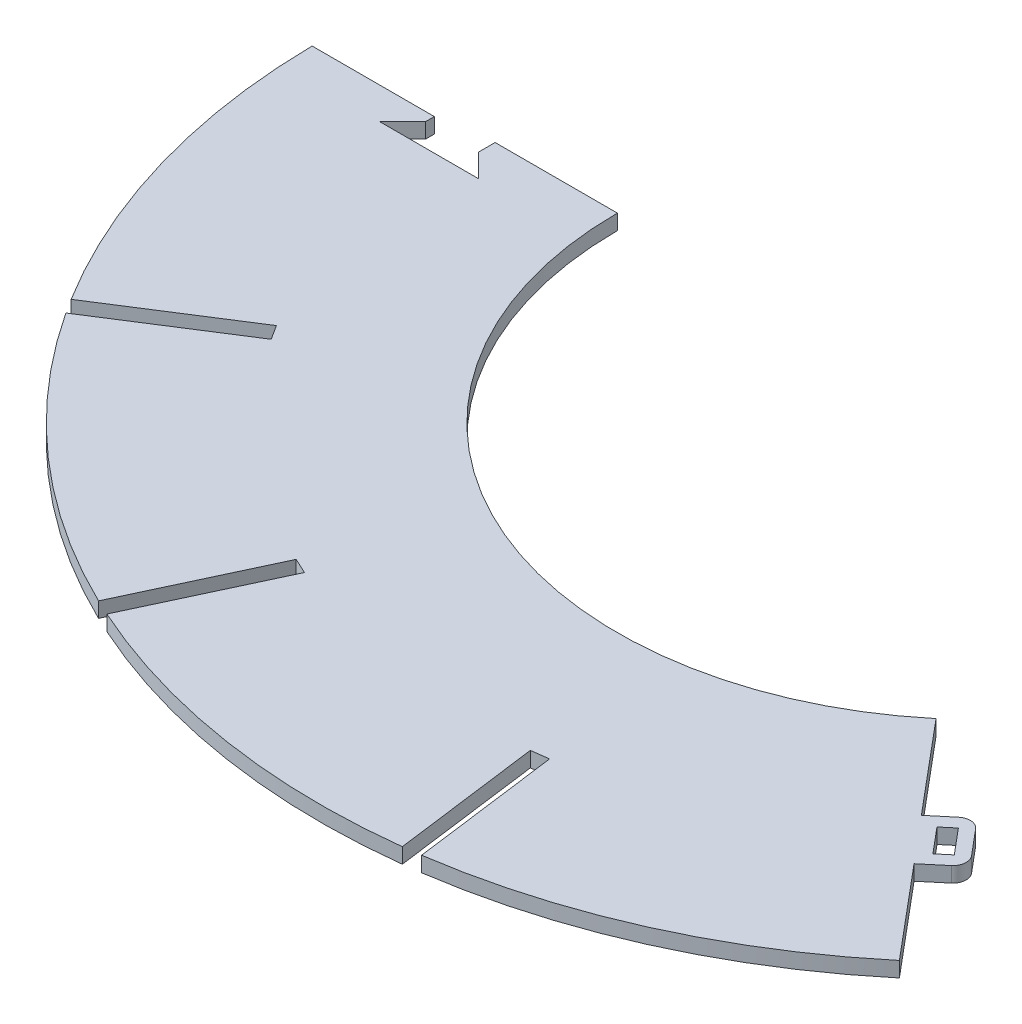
SolidWorks part; units mm, degrees
ref_plane "Alzado" through (0, 0, 0) normal (0, 0, 1) x (1, 0, 0)
ref_plane "Planta" through (0, 0, 0) normal (0, 1, 0) x (1, 0, 0)
ref_plane "Vista lateral" through (0, 0, 0) normal (1, 0, 0) x (0, 0, -1)
sketch "Croquis1" plane through (0, 0, 0) normal (0, 1, 0) x (1, 0, 0)
  line L0 (-1220, 610) -> (1220, 610) construction
  line L1 (-1220, 610) -> (-1220, -610) construction
  line L2 (1220, 610) -> (1220, -610) construction
  line L3 (1220, -610) -> (-1220, -610) construction
  line L4 (-875.8964, -108.611) -> (-875.9521, -108.6465)
  line L5 (488.8159, -101.6911) -> (546.6668, -170.6351) construction
  line L6 (-675.3886, -4.5873) -> (-675.4037, -4.5969)
  line L7 (-459.3946, -482.4337) -> (-459.4225, -482.4936)
  line L8 (-365.6503, -277.849) -> (-342.0863, -288.8371)
  line L10 (61.8741, -351.0126) -> (87.6517, -347.6189)
  line L11 (469.8808, -143.6877) -> (502.0202, -181.9899)
  line L14 (-761.3817, 418.9541) -> (-761.3817, 393.9541)
  line L15 (501.6716, -117.012) -> (533.811, -155.3142)
  line L17 (500.7041, -209.2024) -> (616.4059, -347.0904)
  line L18 (-576.3817, 418.9541) -> (-761.3817, 418.9541)
  line L19 (-841.3817, 393.9541) -> (-841.3817, 406.9541)
  line L20 (327.1514, -2.3704) -> (442.8532, -140.2584)
  line L21 (-841.3817, 393.9541) -> (-876.3817, 358.9541)
  line L22 (-876.3817, 358.9541) -> (-726.3817, 358.9541)
  line L23 (-726.3817, 358.9541) -> (-761.3817, 393.9541)
  line L24 (502.0202, -181.9899) -> (519.6392, -167.2058)
  line L26 (500.7041, -209.2024) -> (531.3459, -183.4909)
  line L27 (473.495, -114.5469) -> (442.8532, -140.2584)
  line L28 (487.4998, -128.9036) -> (469.8808, -143.6877)
  line L29 (500.7041, -209.2024) -> (546.6668, -170.6351) construction
  line L30 (486.3507, -129.8677) -> (455.709, -155.5792) construction
  line L31 (487.8483, -193.8815) -> (518.4901, -168.17) construction
  line L32 (488.8159, -101.6911) -> (442.8532, -140.2584) construction
  line L33 (-684.5227, 9.7504) -> (-684.5378, 9.7408)
  line L35 (-686.9097, 13.5653) -> (-876.6922, -107.3395)
  line L36 (-438.5495, -492.1539) -> (-438.5775, -492.2138)
  line L40 (487.4998, -128.9036) -> (519.6392, -167.2058)
  line L45 (-686.9097, 13.5653) -> (-672.9535, -8.3715)
  line L47 (-365.6503, -277.849) -> (-460.749, -481.7889)
  line L49 (61.8741, -351.0126) -> (91.2455, -574.1102)
  line L51 (-841.3817, 406.9541) -> (-1026.3097, 406.9541)
  line L53 (-672.9535, -8.3715) -> (-862.7224, -129.2676)
  line L55 (-342.0863, -288.8371) -> (-437.185, -492.7769)
  line L57 (87.6517, -347.6189) -> (117.023, -570.7165)
  line L62 (-1026.3317, 408.9541) -> (-1026.3817, 408.9541)
  line L66 (486.3507, -129.8677) -> (518.4901, -168.17) construction
  arc A2 (327.1514, -2.3704) -> (-576.3817, 418.9541) centre (-26.3817, 418.9541) cw
  arc A3 (616.4059, -347.0904) -> (116.5273, -570.7817) centre (-26.3817, 418.9541) cw
  arc A4 (533.811, -155.3142) -> (531.3459, -183.4909) centre (518.4901, -168.17) cw
  arc A5 (501.6716, -117.012) -> (473.495, -114.5469) centre (486.3507, -129.8677) ccw
  arc A19 (91.7412, -574.0449) -> (-437.6381, -492.5656) centre (-26.3817, 418.9541) cw
  arc A23 (-460.2958, -482.0002) -> (-862.991, -128.8459) centre (-26.3817, 418.9541) cw
  arc A24 (-876.4235, -107.7612) -> (-1026.3317, 408.9541) centre (-26.3817, 418.9541) cw
  point P2 (-26.3817, 801.0459)
  point P8 (-865.2061, -125.5144)
  point P10 (616.4059, 1567.0904)
  point P11 (-1026.3817, 801.0459)
  point P14 (-346.18, -286.9682)
  point P15 (-441.2964, -490.946)
  point P17 (92.7428, -573.9918)
  point P21 (-1026.3817, 418.9541)
  point P27 (458.1741, -127.4026)
  point P32 (516.025, -196.3466)
  point P39 (63.3633, -350.8321)
  point P46 (83.1949, -348.2422)
  point P47 (112.5717, -571.3813)
  point P49 (104.1445, 1792.4908)
  point P51 (86.1665, -347.83)
  point P52 (-343.4523, -288.2172)
  point P56 (-874.3402, -111.1767)
  point P57 (104.1445, -572.4908)
  point P58 (-449, -487.3537)
  point P59 (-869.7732, -118.3455)
  point P60 (45.4077, 1346.3406)
  point P61 (-449, 1707.3537)
  point P62 (-869.7732, 1338.3455)
  point P63 (-258.8218, 1299.5152)
  point P64 (-490.247, 1096.5607)
  point P65 (45.4077, -126.3406)
  point P66 (-258.8218, -79.5152)
  point P67 (-490.247, 123.4393)
  point P68 (-26.3817, 801.0459)
  point P69 (471.7787, 1394.7304)
  point P70 (-801.3817, 801.0459)
  point P71 (-26.3817, 418.9541)
  point P72 (471.7787, -174.7304)
  point P73 (-801.3817, 418.9541)
  point P74 (-484.874, 1104.9946)
  point P75 (-864.4002, 1346.7794)
  point P76 (-249.7587, 1303.7414)
  point P77 (-439.9369, 1711.5799)
  point P78 (55.3221, 1345.0353)
  point P79 (114.0589, 1791.1855)
  point P80 (-495.62, 131.8732)
  point P81 (-875.1462, -109.9116)
  point P82 (-267.8849, -75.289)
  point P83 (-458.0631, -483.1275)
  point P84 (35.4932, -127.6459)
  point P85 (94.23, -573.796)
  point P87 (-863.5942, -128.0445)
  point P88 (-361.5872, -279.7837)
  point P89 (-456.7036, -483.7614)
  point P90 (-495.62, 1088.1268)
  point P91 (-875.1462, 1329.9116)
  point P92 (-267.8849, 1295.289)
  point P93 (-458.0631, 1703.1275)
  point P96 (-484.874, 115.0054)
  point P97 (-864.4002, -126.7794)
  point P98 (-249.7587, -83.7414)
  point P99 (-439.9369, -491.5799)
  point P100 (55.3221, -125.0353)
  point P101 (114.0589, -571.1855)
  point P102 (-841.3817, 408.9541)
  point P104 (84.6821, -348.0465)
  point P106 (66.3404, -350.4612)
  point P107 (95.7172, -573.6003)
  point P109 (115.5461, -570.9897)
  point P110 (-364.2974, -278.497)
  point P117 (64.8532, -350.657)
  point P118 (-344.8205, -287.6022)
  point P121 (-362.9467, -279.1498)
  point P122 (-674.5827, -5.8524)
  point P123 (-685.3287, 11.0155)
  point P130 (-673.7592, -7.1063)
  point P131 (-686.1171, 12.2917)
  dimension "D10" = 150
  dimension "D12" = 25
  dimension "D13" = 45
  dimension "D14" = 45
  dimension "D15" = 450
extrude "Saliente-Extruir1" add sketch "Croquis1" along normal blind 23
